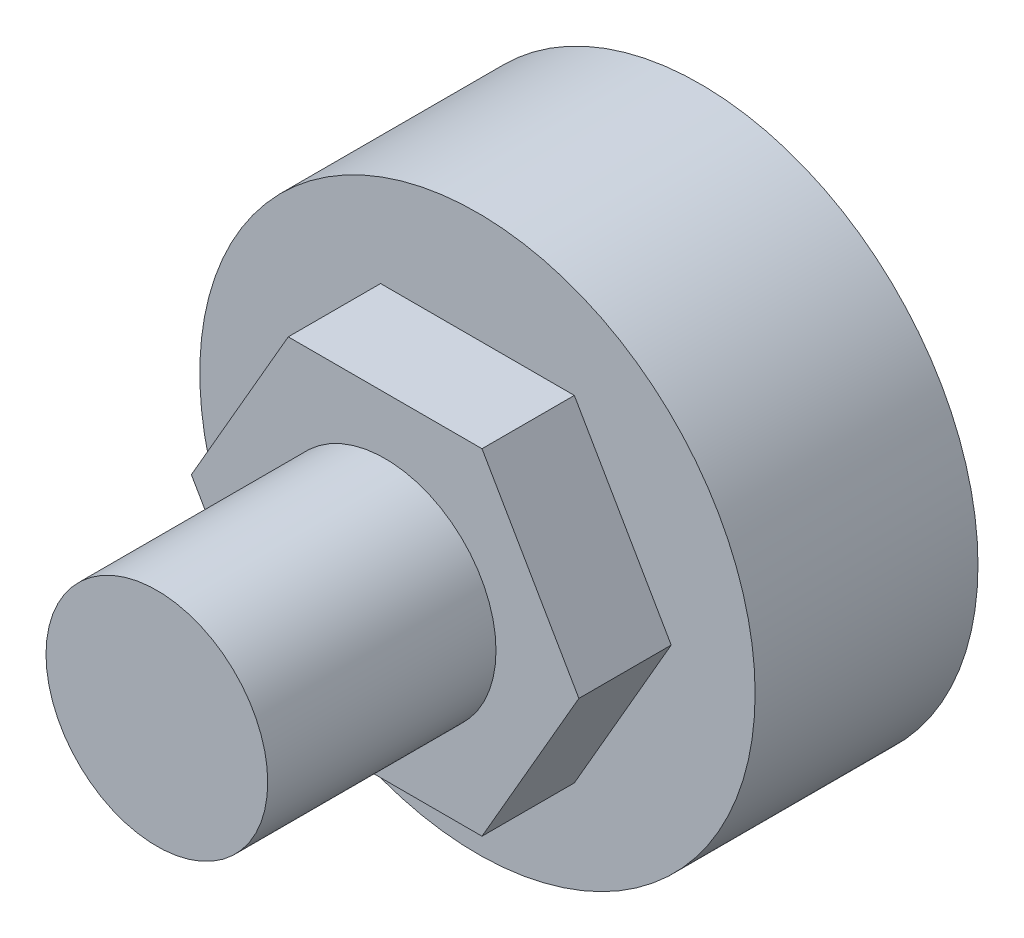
SolidWorks part; units mm, degrees
ref_plane "Front Plane" through (0, 0, 0) normal (0, 0, 1) x (1, 0, 0)
ref_plane "Top Plane" through (0, 0, 0) normal (0, 1, 0) x (1, 0, 0)
ref_plane "Right Plane" through (0, 0, 0) normal (1, 0, 0) x (0, 0, -1)
sketch "Sketch1" plane through (0, 0, 0) normal (0, 0, 1) x (1, 0, 0)
  circle A0 centre (0, 0) radius 9.805
  dimension "D1" = 19.61
extrude "Boss-Extrude1" add sketch "Sketch1" along normal blind 7.87
sketch "Sketch2" plane through (0, 0, 7.87) normal (0, 0, 1) x (1, 0, 0)
  line L1 (3.4208, 5.925) -> (-3.4208, 5.925)
  line L2 (-3.4208, 5.925) -> (-6.8416, 0)
  line L3 (-6.8416, 0) -> (-3.4208, -5.925)
  line L4 (-3.4208, -5.925) -> (3.4208, -5.925)
  line L5 (3.4208, -5.925) -> (6.8416, 0)
  line L6 (6.8416, 0) -> (3.4208, 5.925)
  circle A0 centre (0, 0) radius 5.925 construction
  dimension "D1" = 11.85
extrude "Boss-Extrude2" add sketch "Sketch2" along normal blind 3.26
sketch "Sketch3" plane through (0, 0, 11.13) normal (0, 0, 1) x (1, 0, 0)
  circle A0 centre (0, 0) radius 3.915
  dimension "D1" = 7.83
extrude "Boss-Extrude3" add sketch "Sketch3" along normal blind 8.06
